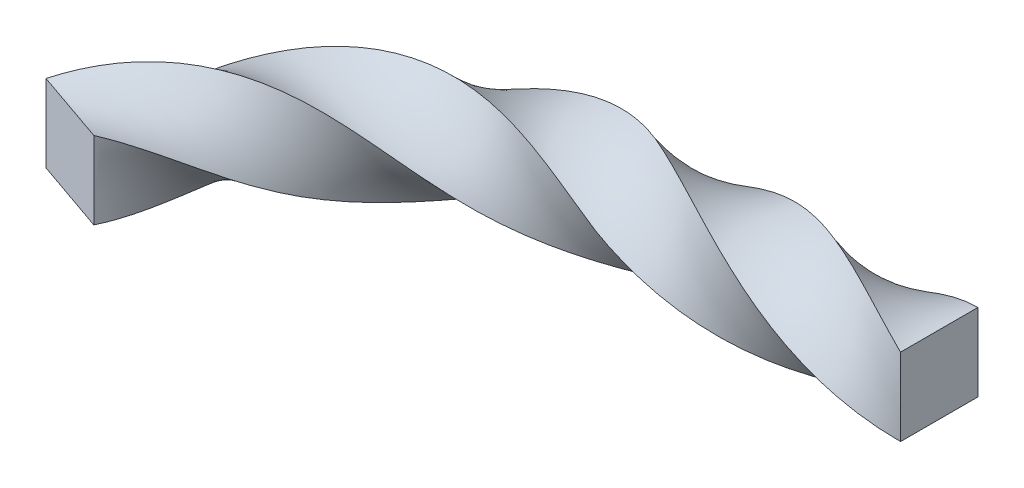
SolidWorks part; units mm, degrees
ref_plane "Front Plane" through (0, 0, 0) normal (0, 0, 1) x (1, 0, 0)
ref_plane "Top Plane" through (0, 0, 0) normal (0, 1, 0) x (1, 0, 0)
ref_plane "Right Plane" through (0, 0, 0) normal (1, 0, 0) x (0, 0, -1)
sketch "Sketch1" plane through (0, 0, 0) normal (0, 1, 0) x (1, 0, 0)
  line L0 (0, 0) -> (-156, 0)
  arc A0 (-156, 0) -> (-340.1983, -131) centre (-156, -195) ccw
  dimension "D1" = 195
  dimension "D2" = 156
  dimension "D3" = 131
sketch "Sketch2" plane through (0, 0, 0) normal (1, 0, 0) x (0, 0, -1)
  line L0 (21, -21) -> (-21, 21) construction
  line L1 (21, -21) -> (-21, -21)
  line L2 (21, -21) -> (21, 21)
  line L3 (21, 21) -> (-21, 21)
  line L4 (-21, -21) -> (-21, 21)
  line L5 (-21, -21) -> (21, 21) construction
  point P5 (0, 0)
  dimension "D1" = 42
sweep "Sweep1" add profiles "Sketch2" path "Sketch1" parameters "D4"=360
